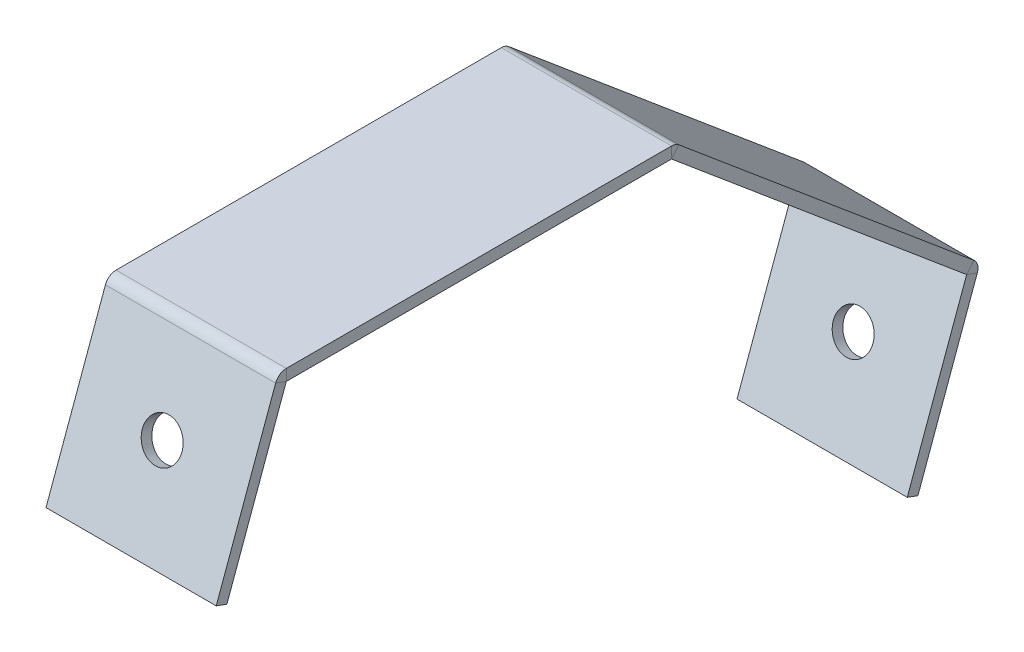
SolidWorks part; units mm, degrees
ref_plane "Front" through (0, 0, 0) normal (0, 0, 1) x (1, 0, 0)
ref_plane "Top" through (0, 0, 0) normal (0, 1, 0) x (1, 0, 0)
ref_plane "Right" through (0, 0, 0) normal (1, 0, 0) x (0, 0, -1)
sketch "Sketch1" plane through (0, 0, 0) normal (0, 1, 0) x (1, 0, 0)
  line L1 (0, 0) -> (15, 0)
  line L2 (0, 0) -> (0, 102)
  line L3 (0, 102) -> (15, 102)
  line L4 (15, 0) -> (15, 102)
  circle A0 centre (7.5, 94) radius 1.75
  circle A1 centre (7.5, 8) radius 1.75
sheet metal parameters "Sheet-Metal1" thickness 1 parameters "D1"=0
base flange "Base-Flange1" sketch "Sketch1" thickness 1 reverse thickness direction yes parameters "D1"=0
sketch "Sketch3" plane through (0, 1, 0) normal (0, 1, 0) x (-1, 0, 0)
  line L3 (-15, -86) -> (0, -86)
  line L4 (-15, -16) -> (0, -16)
sketched bend "Sketched Bend1" parameters "D1"=0
bend "SketchBend1" bend radius 0 bend angle 70 parameters "D5"=1
bend "SketchBend2" bend radius 0 bend angle 70 parameters "D5"=2
sketch "Sketch4" plane through (0, 1, 0) normal (0, 1, 0) x (-1, 0, 0)
  line L0 (0, -51) -> (-15, -51)
  line L1 (0, -85.3048) -> (0, -16.6952) construction
  line L2 (-15, -16.6952) -> (-15, -85.3048) construction
sketched bend "Sketched Bend3" parameters "D1"=0
bend "SketchBend3" bend radius 0 bend angle 40 parameters "D5"=3
flat pattern "Flat-Pattern1"
sketch "Bend-Lines1" plane through (0, 1, 0) normal (0, 1, 0) x (-1, 0, 0)
  line L0 (-15, -51) -> (0, -51) construction
  line L1 (0, -16) -> (-15, -16) construction
  line L2 (-15, -86) -> (0, -86) construction
bend of the flat pattern "Flatten-<SketchBend1>1"
bend of the flat pattern "Flatten-<SketchBend2>1"
bend of the flat pattern "Flatten-<SketchBend3>1"
